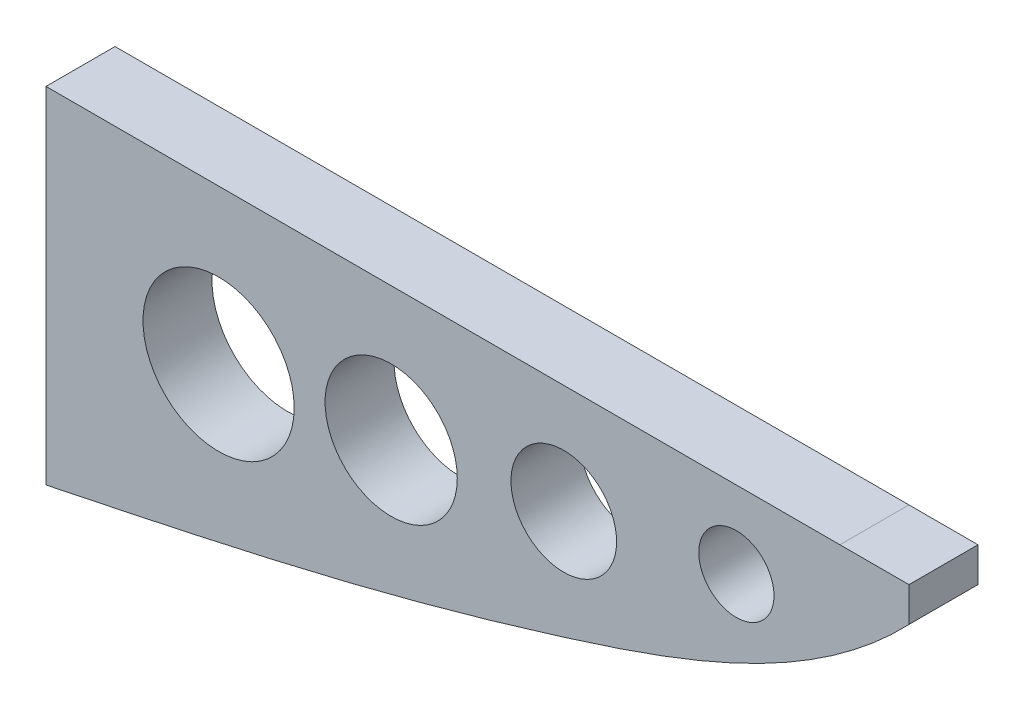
SolidWorks part; units mm, degrees
ref_plane "Ebene vorne" through (0, 0, 0) normal (0, 0, 1) x (1, 0, 0)
ref_plane "Ebene oben" through (0, 0, 0) normal (0, 1, 0) x (1, 0, 0)
ref_plane "Ebene rechts" through (0, 0, 0) normal (1, 0, 0) x (0, 0, -1)
sketch "Skizze1" plane through (0, 0, 0) normal (0, 0, 1) x (1, 0, 0)
  line L0 (0, 0) -> (94.8472, 0) construction
  line L1 (0, -50) -> (0, 50)
  line L2 (0, 50) -> (250, 50)
  line L3 (50, 50) -> (50, -39.4)
  line L4 (100, 50) -> (100, -27.5)
  line L5 (150, 50) -> (150, -13.2)
  line L6 (200, 50) -> (200, 5.3)
  line L7 (250, 50) -> (250, 40)
  circle A0 centre (200, 27.65) radius 10.9
  circle A1 centre (150, 18.4) radius 15.3
  circle A2 centre (100, 11.25) radius 19.15
  circle A3 centre (50, 5.3) radius 21.9
  circle A4 centre (0, 0) radius 24.5
  spline S0 degree 3 poles (0, -50) (33.4199, -43.0609) (83.9633, -32.5542) (169.944, -7.8832) (222.6154, 11.3744) (250, 40) knots 0 0 0 0 0.381515 0.575066 1 1 1 1
  point P14 (-115.2196, 98.0463)
  point P20 (200, 27.65)
  point P21 (150, 18.4)
  point P22 (100, 11.25)
  point P23 (50, 5.3)
  dimension "D13" = 21.8
  dimension "D14" = 30.6
  dimension "D15" = 38.3
  dimension "D16" = 43.8
  dimension "D17" = 49
  dimension "D1" = 100
  dimension "D2" = 50
  dimension "D3" = 250
  dimension "D4" = 50
  dimension "D5" = 50
  dimension "D6" = 50
  dimension "D7" = 50
  dimension "D8" = 89.4
  dimension "D9" = 77.5
  dimension "D10" = 63.2
  dimension "D11" = 44.7
  dimension "D12" = 10
extrude "Aufsatz-Linear austragen1" add sketch "Skizze1" along normal blind 20 contours L1 L2 L7 S0
sketch "Skizze2" plane through (0, 50, 0) normal (0, 1, 0) x (1, 0, 0)
  line L0 (230, -20) -> (230, 0)
  line L1 (0, -20) -> (250, -20) construction
  line L2 (0, 0) -> (250, 0) construction
  line L3 (250, -20) -> (250, 0) construction
  dimension "D1" = 20
sketch "Skizze3" plane through (0, 0, 20) normal (0, 0, 1) x (1, 0, 0)
  line L0 (250, 50) -> (250, 40) construction
  line L2 (0, 50) -> (230, 50) construction
  circle A0 centre (200, 27.65) radius 10.9
  circle A1 centre (150, 18.4) radius 15.3
  circle A2 centre (100, 11.25) radius 19.15
  circle A3 centre (50, 5.3) radius 21.9
  point P14 (50, 5.3)
  point P15 (100, 11.25)
  point P16 (150, 18.4)
  point P17 (200, 27.65)
  dimension "D5" = 21.8
  dimension "D6" = 30.6
  dimension "D7" = 38.3
  dimension "D8" = 43.8
  dimension "D1" = 50
  dimension "D2" = 100
  dimension "D3" = 150
  dimension "D4" = 200
  dimension "D11" = 22.35
  dimension "D12" = 31.6
  dimension "D13" = 38.75
  dimension "D14" = 44.7
extrude "Schnitt-Linear austragen1" cut sketch "Skizze3" against normal through all
